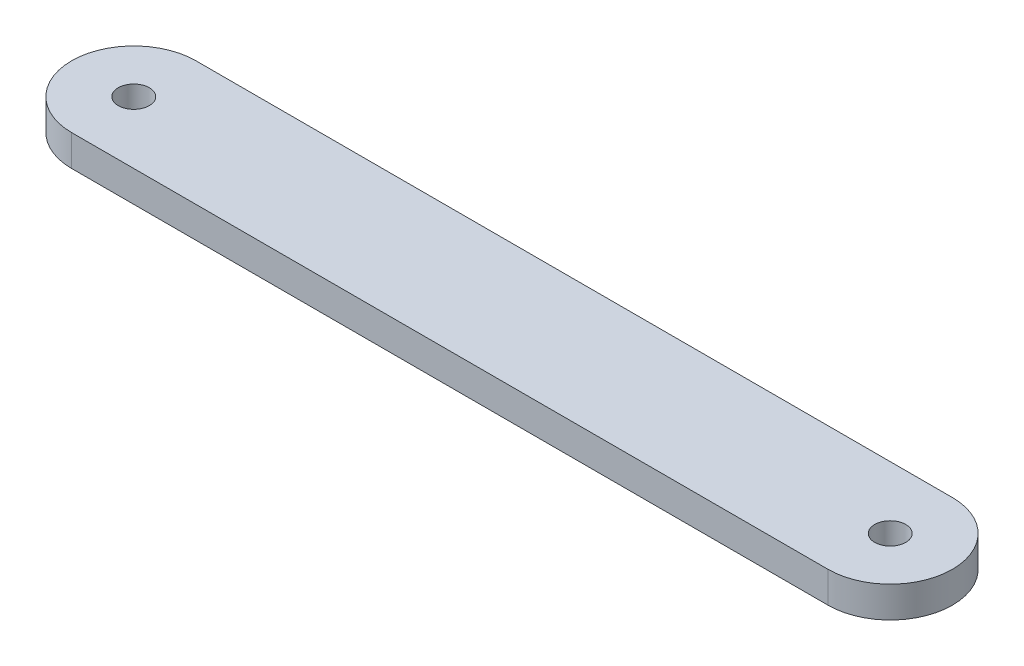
SolidWorks part; units mm, degrees
ref_plane "Front Plane" through (0, 0, 0) normal (0, 0, 1) x (1, 0, 0)
ref_plane "Top Plane" through (0, 0, 0) normal (0, 1, 0) x (1, 0, 0)
ref_plane "Right Plane" through (0, 0, 0) normal (1, 0, 0) x (0, 0, -1)
sketch "Sketch1" plane through (0, 0, 0) normal (0, 1, 0) x (1, 0, 0)
  line L0 (0, 12.7) -> (154.5082, 12.7)
  line L1 (0, -12.7) -> (154.5082, -12.7)
  circle A0 centre (0, 0) radius 3.175
  circle A1 centre (0, 0) radius 12.7
  circle A2 centre (154.5082, 0) radius 12.7
  circle A3 centre (154.5082, 0) radius 3.175
  point P10 (125.4514, -32.4721)
  dimension "D1" = 6.35
  dimension "D2" = 25.4
  dimension "D3" = 154.5082
  dimension "D4" = 25.4
  dimension "D5" = 6.35
  dimension "D6" = 154.5082
  dimension "D7" = 12.7
extrude "Boss-Extrude1" add sketch "Sketch1" along normal blind 6.35 contours A1 A0 | A2 L0 A1 L1 | A2 A3
